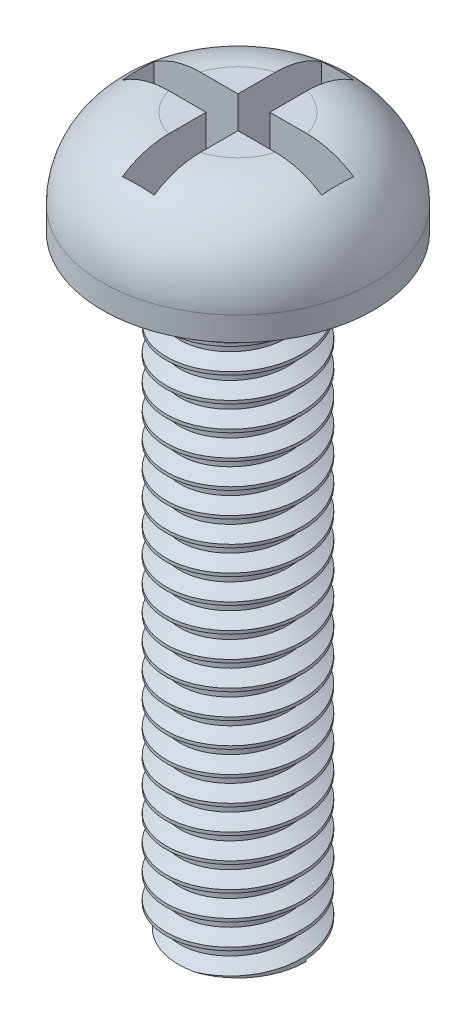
SolidWorks part; units mm, degrees
ref_plane "Front Plane" through (0, 0, 0) normal (0, 0, 1) x (1, 0, 0)
ref_plane "Top Plane" through (0, 0, 0) normal (0, 1, 0) x (1, 0, 0)
ref_plane "Right Plane" through (0, 0, 0) normal (1, 0, 0) x (0, 0, -1)
sketch "Sketch1" plane through (0, 0, 0) normal (0, 1, 0) x (1, 0, 0)
  circle A0 centre (0, 0) radius 4.318
extrude "Boss-Extrude1" add sketch "Sketch1" along normal blind 3.302
sketch "Sketch2" plane through (0, 3.302, 0) normal (0, 1, 0) x (1, 0, 0)
  line L0 (0.508, 0.508) -> (3.175, 0.508)
  line L1 (-0.508, -3.175) -> (0.508, -3.175)
  line L2 (-0.508, -3.175) -> (-0.508, -0.508)
  line L3 (-0.508, 3.175) -> (0.508, 3.175)
  line L4 (0.508, -3.175) -> (0.508, -0.508)
  line L5 (0.508, 0.508) -> (0.508, 3.175)
  line L6 (0.508, -0.508) -> (3.175, -0.508)
  line L7 (-3.175, 0.508) -> (-0.508, 0.508)
  line L8 (-3.175, 0.508) -> (-3.175, -0.508)
  line L9 (-3.175, -0.508) -> (-0.508, -0.508)
  line L10 (3.175, 0.508) -> (3.175, -0.508)
  line L11 (-0.508, 0.508) -> (-0.508, 3.175)
  point P6 (0, 0)
extrude "Cut-Extrude1" cut sketch "Sketch2" against normal blind 2.54
fillet "Fillet2" radius 2.54 1 edges at (0, 3.302, 4.318)
sketch "Sketch3" plane through (0, 0, 0) normal (0, -1, 0) x (1, 0, 0)
  circle A0 centre (0, 0) radius 2.159
extrude "Boss-Extrude2" add sketch "Sketch3" along normal blind 19.05
thread "Thread1" pitch 0.7937 start angle 0, offset 0.635, length 19.05, pitch 0.7937, diameter 4.318
ref_plane "Plane1" through (2.159, -19.685, 0) normal (0, 0, 1) x (1, 0, 0)
sketch "Thread Profile1" plane through (2.159, -19.685, 0) normal (0, 0, 1) x (1, 0, 0)
  line L0 (0, 0) -> (0, 0.7937) construction
  line L11 (0, 0) -> (0, 0.6945)
  line L12 (0, 0.6945) -> (-0.4296, 0.4465)
  line L13 (-0.4296, 0.4465) -> (-0.4296, 0.248)
  line L15 (-0.4296, 0.248) -> (0, 0)
  line L17 (-0.4296, 0.3473) -> (0, 0.3473) construction
  point P2 (0, 0)
  dimension "Pitch" = 0.7937
  dimension "Profile_Angle" = 60
  dimension "Profile_Land" = 0.1984
  dimension "Profile_Height" = 0.4296
